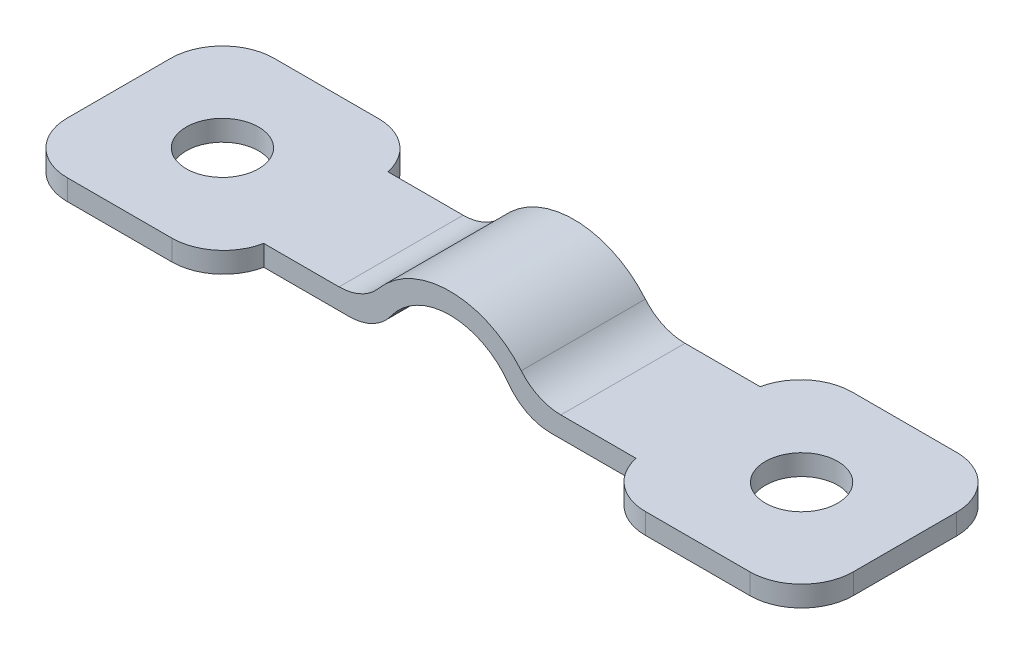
SolidWorks part; units mm, degrees
ref_plane "Front Plane" through (0, 0, 0) normal (0, 0, 1) x (1, 0, 0)
ref_plane "Top Plane" through (0, 0, 0) normal (0, 1, 0) x (1, 0, 0)
ref_plane "Right Plane" through (0, 0, 0) normal (1, 0, 0) x (0, 0, -1)
sketch "Sketch1" plane through (0, 0, 0) normal (0, 0, 1) x (1, 0, 0)
  line L3 (-3.3541, 1) -> (-19, 1)
  line L4 (-3.3541, 1) -> (-3.3541, 2)
  line L5 (-3.3541, 2) -> (-19, 2)
  line L6 (-19, 1) -> (-19, 2)
  line L7 (3.3541, 1) -> (19, 1)
  line L8 (3.3541, 1) -> (3.3541, 2)
  line L9 (3.3541, 2) -> (19, 2)
  line L10 (19, 1) -> (19, 2)
  arc A0 (3.3541, 1) -> (-3.3541, 1) centre (0, 0) ccw
  arc A2 (4.3875, 1) -> (-4.3875, 1) centre (0, 0) ccw
  point P12 (-4.4369, 0.755)
  point P13 (4.3403, 1.1924)
  dimension "D1" = 7
  dimension "D2" = 1
  dimension "D3" = 9
  dimension "D4" = 1
  dimension "D5" = 1
  dimension "D6" = 1
  dimension "D7" = 38
extrude "Boss-Extrude1" add sketch "Sketch1" along normal blind 10 contours A2 L5 L6 L3 | L9 A2 L5 L4 A0 L8 | L5 A2 L3 L4
sketch "Sketch2" plane through (0, 2, 0) normal (0, 1, 0) x (1, 0, 0)
  line L0 (4.0311, 0) -> (19, 0) construction
  line L1 (-19, -10) -> (-9, -10)
  line L2 (-19, -10) -> (-19, 0)
  line L3 (-19, 0) -> (-9, 0)
  line L4 (-9, -10) -> (-9, 0)
  line L5 (19, -10) -> (9, -10)
  line L6 (19, -10) -> (19, 0)
  line L7 (19, 0) -> (9, 0)
  line L8 (9, -10) -> (9, 0)
  line L9 (-4.0311, 0) -> (-19, 0) construction
  line L10 (-4.0311, -10) -> (-19, -10) construction
  line L11 (-9, 0) -> (9, 0)
  line L12 (-9, 0) -> (-9, -2)
  line L13 (-9, -2) -> (9, -2)
  line L14 (9, 0) -> (9, -2)
  line L16 (-9, -10) -> (9, -10)
  line L17 (-9, -10) -> (-9, -8)
  line L18 (-9, -8) -> (9, -8)
  line L19 (9, -10) -> (9, -8)
  dimension "D1" = 10
  dimension "D2" = 10
  dimension "D3" = 8
  dimension "D4" = 2
extrude "Cut-Extrude1" cut sketch "Sketch2" against normal through all both and the other way through all contours L4 L13 M13 M10 | L13 L8 L11 M13 | L18 L4 M12 M13 | L18 L16 L8 M13
sketch "Sketch3" plane through (0, 2, 0) normal (0, 1, 0) x (1, 0, 0)
  line L0 (-14, 0) -> (-14, -10) construction
  line L1 (-9, 0) -> (-19, 0) construction
  line L2 (-9, -10) -> (-19, -10) construction
  line L3 (14, 0) -> (14, -10) construction
  line L4 (9, 0) -> (19, 0) construction
  line L5 (9, -10) -> (19, -10) construction
  circle A0 centre (-14, -5) radius 1.75
  circle A1 centre (14, -5) radius 1.75
  dimension "D1" = 3.5
extrude "Cut-Extrude2" cut sketch "Sketch3" against normal through all
fillet "Fillet2" radius 2.5 10 edges at (-19, 1.5, 0) (-19, 1.5, 10) (19, 1.5, 10) (19, 1.5, 0) (9, 2, 1) (-9, 1.5, 0) (-9, 2, 1) (9, 1, 1) (9, 1.5, 0) (-9, 1, 1)
fillet "Fillet3" radius 2.5 4 edges at (3.3541, 1, 5) (4.0311, 2, 5) (-4.0311, 2, 5) (-3.3541, 1, 5)
fillet "Fillet4" radius 2.5 6 edges at (9, 2, 9) (-9, 1.5, 10) (9, 1.5, 10) (9, 1, 9) (-9, 2, 9) (-9, 1, 9)
